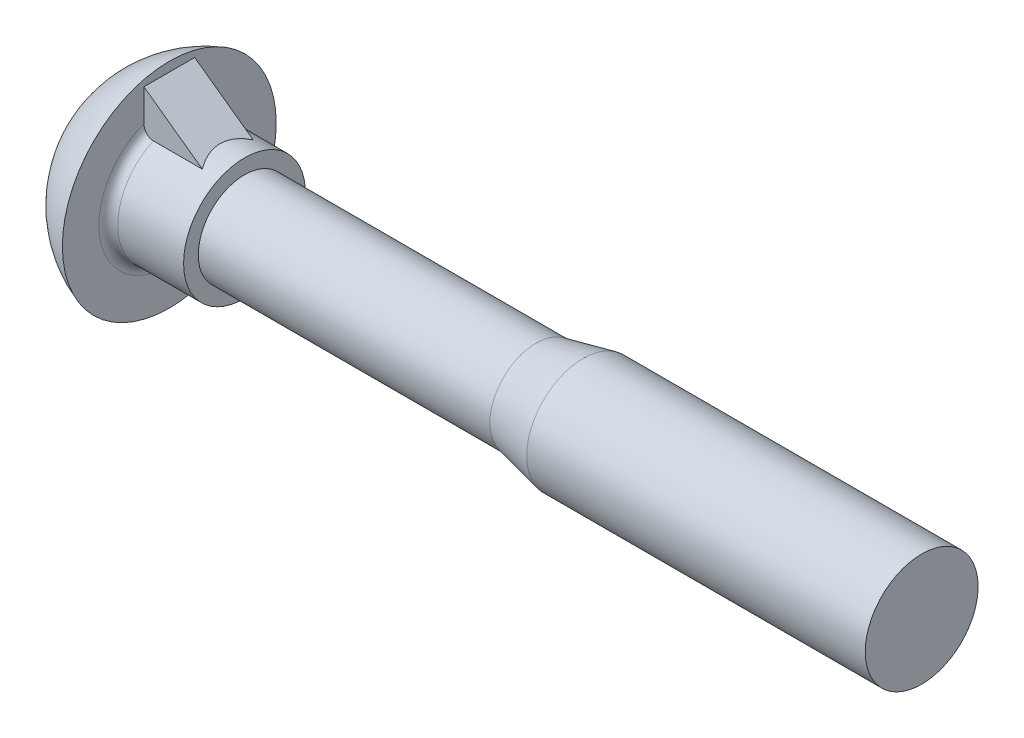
SolidWorks part; units mm, degrees
ref_plane "Front" through (0, 0, 0) normal (0, 0, 1) x (1, 0, 0)
ref_plane "Top" through (0, 0, 0) normal (0, 1, 0) x (1, 0, 0)
ref_plane "Right" through (0, 0, 0) normal (1, 0, 0) x (0, 0, -1)
other "Configuration Table"
sketch "Sketch1" plane through (0, 0, 0) normal (0, 0, 1) x (1, 0, 0)
  line L0 (-31.4843, 0) -> (43.5502, 0) construction
  line L1 (44.08, 0) -> (44.08, 3)
  line L2 (44.08, 3) -> (8.08, 3)
  line L3 (8.08, 3) -> (8.08, 3.24)
  line L4 (8.08, 3.24) -> (4.58, 3.24)
  line L5 (4.08, 3.74) -> (4.08, 5.6845)
  line L6 (44.08, 0) -> (0, 0)
  arc A0 (4.08, 5.6845) -> (0, 0) centre (6, 0) ccw
  arc A1 (4.58, 3.24) -> (4.08, 3.74) centre (4.58, 3.74) cw
  point P13 (4.08, 3.24)
revolve "Base" add sketch "Sketch1" angle 360 about L0
sketch "Sketch2" plane through (0, 0, 0) normal (0, 0, 1) x (1, 0, 0)
  line L1 (6.78, 3.24) -> (4.08, 5.1845)
  line L2 (8.08, 3.24) -> (4.58, 3.24) construction
  line L3 (4.08, -5.6845) -> (4.08, 5.6845) construction
  line L4 (-31.4843, 0) -> (43.5502, 0) construction
rib "Nib" sketch "Sketch2" sketch "Sketch2" thickness 2.7 extrusion direction parallel to sketch draft on no parameters "Sn"=2.7
sketch "Sketch3" plane through (0, 0, 0) normal (0, 0, 1) x (1, 0, 0)
  line L0 (26.08, 3) -> (23.58, 2.4585)
  line L1 (0, 0) -> (55.457, 0) construction
  line L2 (23.58, 2.4585) -> (8.08, 2.4585)
  line L3 (44.08, -3) -> (44.08, 3) construction
  line L4 (8.08, 2.4585) -> (8.08, 3)
  line L5 (8.08, 3) -> (26.08, 3)
  line L6 (-29.8163, 0) -> (1.1759, 0) construction
revolve "Cut-Revolve1" cut sketch "Sketch3" angle 360 about L6
sketch "Sketch4" plane through (0, 0, 0) normal (0, 0, 1) x (1, 0, 0)
  line L0 (43.8092, 3.2) -> (44.3507, 3.2)
  line L1 (44.3507, 3.2) -> (44.3507, 3)
  line L2 (44.3507, 3) -> (44.08, 2.531)
  line L3 (44.08, -3) -> (44.08, 3) construction
  line L5 (43.8092, 3) -> (44.08, 2.531)
  line L6 (43.8092, 3.2) -> (43.8092, 3)
  line L8 (44.08, 0) -> (39.6447, 0) construction
  line L9 (43.8092, 3) -> (44.3507, 3) construction
  line L10 (44.08, 3) -> (44.08, 2.531) construction
  point P10 (44.08, 3.2)
revolve "Cut-Revolve10" [suppressed] cut sketch "Sketch4" angle 360 about L8
pattern_linear "LPattern10" [suppressed] count 55 spacing 0.6498 along (1, 0, 0)
equation "\"D2@Sketch2\" = sqr ( \"r@Sketch1\" * \"r@Sketch1\" -  ( \"r@Sketch1\" - \"k@Sketch1\" )  *  ( \"r@Sketch1\" - \"k@Sketch1\" )  ) -0.5"
equation "\"D2@Sketch4\" =  ( \"d@Sketch1\" - \"D2@ThreadCosmetic1\" )  / 2"
equation "\"D3@LPattern10\" = 1.2 * \"D2@Sketch4\" "
equation "\"D1@LPattern10\" =  ( \"l@Sketch1\" - \"h@Sketch1\" )  /  \"D3@LPattern10\""
equation "\"D1@Sketch3\" = \"D2@ThreadCosmetic1\""
equation "\"D3@Sketch4\" = \"d@Sketch1\""
